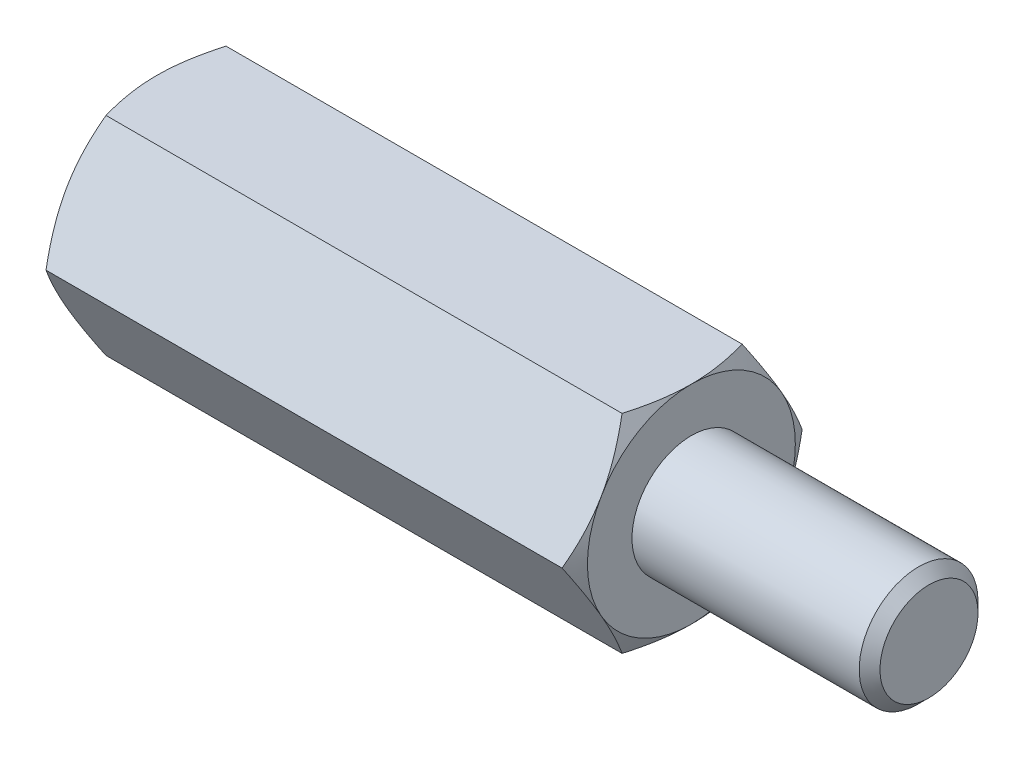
SolidWorks part; units mm, degrees
ref_plane "Front Plane" through (0, 0, 0) normal (0, 0, 1) x (1, 0, 0)
ref_plane "Top Plane" through (0, 0, 0) normal (0, 1, 0) x (1, 0, 0)
ref_plane "Right Plane" through (0, 0, 0) normal (1, 0, 0) x (0, 0, -1)
sketch "Sketch1" plane through (0, 0, 0) normal (1, 0, 0) x (0, 0, -1)
  line L1 (2.0207, 3.5) -> (-2.0207, 3.5)
  line L2 (-2.0207, 3.5) -> (-4.0415, 0)
  line L3 (-4.0415, 0) -> (-2.0207, -3.5)
  line L4 (-2.0207, -3.5) -> (2.0207, -3.5)
  line L5 (2.0207, -3.5) -> (4.0415, 0)
  line L6 (4.0415, 0) -> (2.0207, 3.5)
  circle A0 centre (0, 0) radius 3.5 construction
  dimension "D1" = 7
extrude "Extrude2" add sketch "Sketch1" along normal mid plane 18
sketch "Sketch2" plane through (0, 0, 0) normal (0, 0, 1) x (1, 0, 0)
  line L0 (-9, 3.5) -> (-7.5, 6.0981)
  line L1 (-9, 6.5) -> (-9, 3.5)
  line L3 (0, 0) -> (50000, 0) construction
  arc A0 (-7.5, 6.0981) -> (-9, 6.5) centre (-8.1962, 6.5) ccw
  dimension "D1" = 30
  dimension "D2" = 3
revolve "Cut-Revolve1" cut sketch "Sketch2" angle 360 about L3
mirror "Mirror1" about plane through (0, 0, 0) normal (1, 0, 0) of "Cut-Revolve1"
sketch "Sketch3" plane through (-9, 0, 0) normal (-1, 0, 0) x (0, 0, 1)
  circle A0 centre (0, 0) radius 1.65
  dimension "D1" = 3.3
extrude "Extrude3" cut sketch "Sketch3" against normal blind 8
sketch "Sketch4" plane through (0, 0, 0) normal (0, 0, 1) x (1, 0, 0)
  line L0 (-1, 0) -> (-1, 1.65)
  line L1 (8.6874, 0) -> (-8.6874, 0) construction
  line L2 (-1, 1.65) -> (-0.0474, 0)
  line L3 (-0.0474, 0) -> (-1, 0)
  line L4 (-9, 1.75) -> (-9, -1.75) construction
  point P4 (-9, 0)
  dimension "D1" = 30
  dimension "D2" = 1.65
  dimension "D3" = 8
revolve "Cut-Revolve2" cut sketch "Sketch4" angle 360 about L3
sketch "Sketch5" plane through (9, 0, 0) normal (1, 0, 0) x (0, 0, -1)
  circle A0 centre (0, 0) radius 2
  dimension "D1" = 4
extrude "Extrude4" add sketch "Sketch5" along normal blind 8
chamfer "Chamfer1" distance 0.35 angle 45 1 edges at (17, 0, -2)
equation "\"D2@Sketch4\" = \"D1@Sketch3\"/2"
